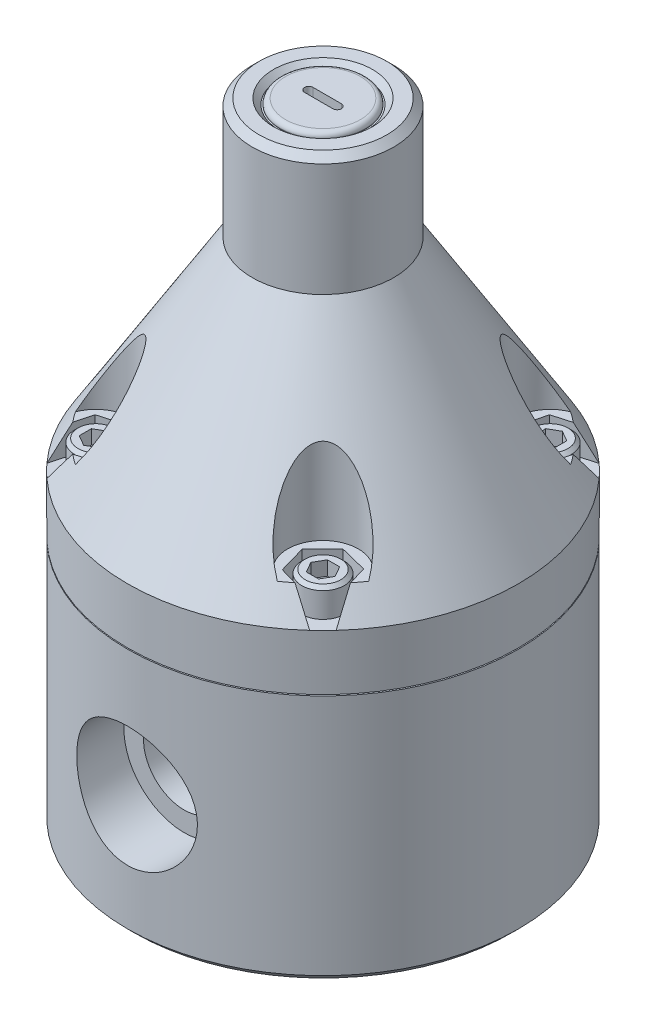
SolidWorks part; units mm, degrees
ref_plane "Front Plane" through (0, 0, 0) normal (0, 0, 1) x (1, 0, 0)
ref_plane "Top Plane" through (0, 0, 0) normal (0, 1, 0) x (1, 0, 0)
ref_plane "Right Plane" through (0, 0, 0) normal (1, 0, 0) x (0, 0, -1)
sketch "Sketch1" plane through (0, 0, 0) normal (0, 1, 0) x (1, 0, 0)
  circle A0 centre (0, 0) radius 43.815
  dimension "D1" = 87.63
extrude "Extrude1" add sketch "Sketch1" along normal blind 140.97
sketch "Sketch2" plane through (0, 0, 0) normal (0, 0, 1) x (1, 0, 0)
  line L0 (0, 0) -> (0, 140.97) construction
  line L1 (43.815, 140.97) -> (-43.815, 140.97) construction
  line L2 (-43.815, 56.134) -> (-43.815, 68.58)
  line L3 (-43.815, 56.134) -> (-30.226, 56.134)
  line L4 (-30.226, 56.134) -> (-30.226, 55.88)
  line L6 (-30.226, 55.88) -> (-49.4473, 55.88)
  line L7 (-49.4473, 55.88) -> (-49.4473, 147.034)
  line L8 (-49.4473, 147.034) -> (-15.875, 147.034)
  line L9 (-15.875, 147.034) -> (-15.875, 114.046)
  line L10 (-15.875, 114.046) -> (-43.815, 68.58)
  line L12 (-43.815, 0) -> (43.815, 0) construction
  dimension "D1" = 43.815
  dimension "D2" = 55.88
  dimension "D3" = 0.254
  dimension "D4" = 30.226
  dimension "D5" = 15.875
  dimension "D6" = 68.58
  dimension "D7" = 26.924
revolve "Cut-Revolve1" cut sketch "Sketch2" angle 360 about L0
ref_plane "Plane1" through (0, 140.97, 0) normal (0, 1, 0) x (-1, 0, 0)
sketch "Sketch3" plane through (0, 140.97, 0) normal (0, 1, 0) x (-1, 0, 0)
  circle A0 centre (0, 0) radius 11.1125
  dimension "D1" = 22.225
extrude "Extrude2" cut sketch "Sketch3" against normal blind 1.27 draft 45
chamfer "Chamfer1" distance 1.5748 angle 45 2 edges at (0, 0, 43.815) (0, 140.97, 15.875)
sketch "Sketch4" plane through (0, 140.97, 0) normal (0, 1, 0) x (-1, 0, 0)
  circle A0 centre (0, 0) radius 9.525
  dimension "D1" = 19.05
extrude "Extrude3" add sketch "Sketch4" against normal up to surface (1.27 mm away)
fillet "Fillet1" radius 1.143 1 edges at (0, 140.97, 9.525)
sketch "Sketch5" plane through (0, 140.97, 0) normal (0, 1, 0) x (-1, 0, 0)
  line L0 (-3.175, 0) -> (3.175, 0) construction
  line L1 (3.175, 0.9652) -> (-3.175, 0.9652)
  line L2 (-3.175, -0.9652) -> (3.175, -0.9652)
  arc A0 (-3.175, 0.9652) -> (-3.175, -0.9652) centre (-3.175, 0) ccw
  arc A1 (3.175, -0.9652) -> (3.175, 0.9652) centre (3.175, 0) ccw
  dimension "D1" = 3.175
  dimension "D2" = 6.35
  dimension "D3" = 0.9652
  dimension "D4" = 0.9652
extrude "Extrude4" cut sketch "Sketch5" against normal blind 3.302 draft 1
ref_plane "Plane2" through (0, 74.93, 0) normal (0, 1, 0) x (-1, 0, 0)
sketch "Sketch6" plane through (0, 74.93, 0) normal (0, 1, 0) x (-1, 0, 0)
  line L0 (0, 0) -> (-43.815, 0) construction
  line L1 (0, 0) -> (-30.9819, 30.9819) construction
  circle A0 centre (0, 0) radius 43.815 construction
  circle A1 centre (0, 0) radius 36.0045 construction
  circle A2 centre (-25.459, 25.459) radius 7.9375
  dimension "D1" = 72.009
  dimension "D2" = 15.875
extrude "Extrude5" cut sketch "Sketch6" along normal blind 22.86
sketch "Sketch8" plane through (0, 74.93, 0) normal (0, 1, 0) x (-1, 0, 0)
  line L0 (0, 0) -> (-30.9819, 30.9819) construction
  line L1 (-30.9819, 19.758) -> (-19.9362, 31.1601) construction
  line L2 (-30.9819, 30.9819) -> (-39.3973, 39.3973) construction
  line L3 (-29.9486, 20.8246) -> (-23.6903, 19.2537)
  line L4 (-23.6903, 19.2537) -> (-19.2007, 23.8882)
  line L5 (-19.2007, 23.8882) -> (-20.9694, 30.0935)
  line L9 (-29.9486, 20.8246) -> (-33.5917, 33.5917)
  line L10 (-33.5917, 33.5917) -> (-20.9694, 30.0935)
  line L12 (-27.2278, 31.6643) -> (-31.7174, 27.0299)
  line L13 (-20.9694, 30.0935) -> (-27.2278, 31.6643)
  line L14 (-31.7174, 27.0299) -> (-29.9486, 20.8246)
  circle A0 centre (0, 0) radius 43.815 construction
  arc A1 (-32.876, 22.6318) -> (-22.6318, 32.876) centre (-25.459, 25.459) ccw construction
  arc A2 (-32.876, 22.6318) -> (-22.6318, 32.876) centre (-25.459, 25.459) ccw construction
  circle A3 centre (-25.459, 25.459) radius 5.588 construction
extrude "Extrude6" cut sketch "Sketch8" against normal blind 6.35
pattern_circular "CirPattern1" count 4 over 360 about axis through (0, 0, 0) along (0, 1, 0) of "Extrude5", "Extrude6"
sketch "Sketch9" plane through (0, 74.93, 0) normal (0, 1, 0) x (-1, 0, 0)
  line L0 (0, 0) -> (-25.459, 25.459) construction
  circle A0 centre (-25.459, 25.459) radius 4.7625
  dimension "D1" = 9.525
extrude "Extrude7" add sketch "Sketch9" against normal up to surface (6.35 mm away)
sketch "Sketch10" plane through (0, 74.93, 0) normal (0, 1, 0) x (-1, 0, 0)
  line L1 (-28.1871, 25.459) -> (-26.8231, 23.0964)
  line L2 (-26.8231, 23.0964) -> (-24.095, 23.0964)
  line L3 (-24.095, 23.0964) -> (-22.7309, 25.459)
  line L4 (-22.7309, 25.459) -> (-24.095, 27.8216)
  line L5 (-24.095, 27.8216) -> (-26.8231, 27.8216)
  line L6 (-26.8231, 27.8216) -> (-28.1871, 25.459)
  circle A0 centre (-25.459, 25.459) radius 2.3626 construction
extrude "Extrude8" cut sketch "Sketch10" against normal blind 3.175
pattern_circular "CirPattern2" count 4 over 360 about axis through (0, 0, 0) along (0, 1, 0) of "Extrude7", "Extrude8"
chamfer "Chamfer2" distance 0.762 angle 45 4 edges at (-25.459, 74.93, -30.2215) (30.2215, 74.93, -25.459) (25.459, 74.93, 30.2215) (-30.2215, 74.93, 25.459)
ref_plane "Plane3" through (0, 0, 43.815) normal (0, 0, 1) x (1, 0, 0)
sketch "Sketch11" plane through (0, 0, 43.815) normal (0, 0, 1) x (1, 0, 0)
  line L0 (0, -6.7756) -> (0, 147.7456) construction
  line L1 (-48.3989, 25.4) -> (47.2148, 25.4) construction
  line L2 (-42.2402, 0) -> (42.2402, 0) construction
  dimension "D1" = 25.4
hole_wizard "CBORE for #00 Binding Head Machine Screw1" positions "3DSketch3" profile "Sketch14" counterbore size "#00" standard "Ansi Inch"
sketch3d "3DSketch3"
  line L0 (0, -6.7756, 43.815) -> (0, 147.7456, 43.815) construction
  point P0 (0, 27.432, 43.815)
sketch "Sketch14" plane through (0, 27.432, 43.815) normal (1, 0, 0) x (0, -1, 0)
  line L0 (0, 0) -> (0, 23.5964)
  line L1 (0, 23.5964) -> (9.1186, 19.05)
  line L2 (9.1186, 19.05) -> (9.1186, 12.7)
  line L3 (9.1186, 12.7) -> (13.5255, 12.7)
  line L4 (13.5255, 12.7) -> (13.5255, 0)
  line L5 (13.5255, 0) -> (0, 0)
  line L10 (0, 23.5964) -> (-9.1186, 19.05) construction
  line L11 (0, -6.35) -> (0, 107.95) construction
  dimension "Hole Dia." = 18.2372
  dimension "Hole Depth" = 19.05
  dimension "C'Bore Dia." = 27.051
  dimension "C'Bore Depth" = 12.7
  dimension "Drill Angle" = 127
mirror "Mirror1" about plane through (0, 0, 0) normal (0, 0, 1) of "CBORE for #00 Binding Head Machine Screw1"
